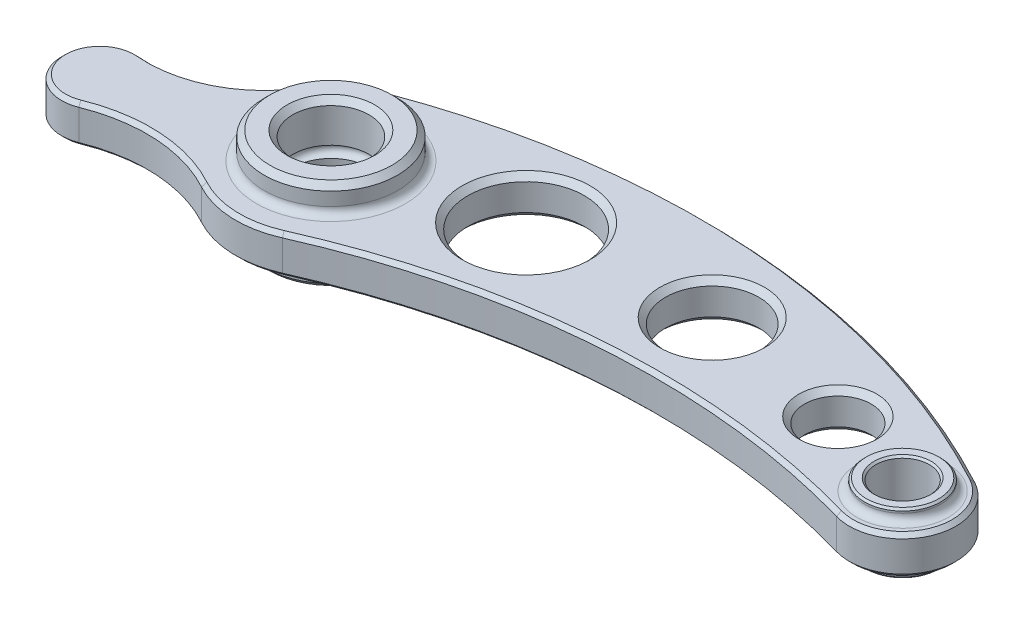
SolidWorks part; units mm, degrees
ref_plane "Front" through (0, 0, 0) normal (0, 0, 1) x (1, 0, 0)
ref_plane "Top" through (0, 0, 0) normal (0, 1, 0) x (1, 0, 0)
ref_plane "Right" through (0, 0, 0) normal (1, 0, 0) x (0, 0, -1)
sketch "Sketch1" plane through (0, 0, 0) normal (0, 1, 0) x (1, 0, 0)
  line L0 (0, 0) -> (150, 0) construction
  line L1 (0, 0) -> (-50, -10.6278) construction
  line L2 (0, 0) -> (-68.199, 0) construction
  arc A0 (-8.8233, 23.3912) -> (-21.1781, 13.2849) centre (0, 0) ccw
  arc A1 (146.1465, -13.4592) -> (156.6415, 12.3244) centre (150, 0) ccw
  arc A2 (10.1219, -22.8593) -> (146.1465, -13.4592) centre (91.0967, -205.7338) cw
  arc A3 (-8.8233, 23.3912) -> (156.6415, 12.3244) centre (61.7633, -163.7385) cw
  circle A4 centre (0, 0) radius 10
  circle A5 centre (150, 0) radius 7
  arc A6 (-21.1781, 13.2849) -> (-49.148, -0.6642) centre (-46.5918, 29.2267) cw
  arc A7 (-46.2534, -19.8994) -> (-12.0257, -21.9176) centre (-31.2668, -56.9859) cw
  arc A8 (-49.148, -0.6642) -> (-46.2534, -19.8994) centre (-50, -10.6278) ccw
  arc A9 (-12.0257, -21.9176) -> (10.1219, -22.8593) centre (0, 0) ccw
  arc A10 (-5.9999, 15.906) -> (152.8463, 5.2819) centre (61.7633, -163.7385) cw construction
  arc A11 (6.8829, -15.5443) -> (148.3485, -5.7682) centre (91.0967, -205.7338) cw construction
  circle A12 centre (0, 0) radius 26 construction
  circle A13 centre (150, 0) radius 18 construction
  circle A14 centre (39.6539, 11.5664) radius 15.3064
  circle A15 centre (124.6104, 8.4037) radius 8.7442
  circle A16 centre (85.6003, 14.4358) radius 12.2382
  circle A17 centre (85.6003, 14.4358) radius 30.7295 construction
  dimension "D2" = 25
  dimension "D3" = 14
  dimension "D4" = 200
  dimension "D5" = 200
  dimension "D6" = 20
  dimension "D7" = 14
  dimension "D10" = 10
  dimension "D11" = 40
  dimension "D12" = 30
  dimension "D1" = 150
  dimension "D8" = 12
  dimension "D9" = 50
  dimension "D13" = 8
  dimension "D14" = 8
  dimension "D15" = 16
  dimension "D16" = 11
extrude "Boss-Extrude1" add sketch "Sketch1" along normal mid plane 10
sketch "Sketch2" plane through (0, 0, 0) normal (0, 1, 0) x (1, 0, 0)
  circle A0 centre (0, 0) radius 10 construction
  circle A1 centre (0, 0) radius 10
  circle A2 centre (0, 0) radius 17.5
  dimension "D1" = 35
extrude "Boss-Extrude2" add sketch "Sketch2" along normal mid plane 24
sketch "Sketch3" plane through (0, 0, 0) normal (0, 1, 0) x (1, 0, 0)
  circle A0 centre (150, 0) radius 7 construction
  circle A1 centre (150, 0) radius 7
  circle A2 centre (150, 0) radius 10
  dimension "D1" = 20
extrude "Boss-Extrude3" add sketch "Sketch3" along normal mid plane 16
chamfer "Chamfer1" distance 1 angle 45 16 edges at (77.3084, 5, 6.2097) (162.967, 5, 5.2781) (-15.829, 5, -19.3506) (75.1101, 5, -35.8157) (77.3084, -5, 6.2097) (162.967, -5, 5.2781) (-15.829, -5, -19.3506) (75.1101, -5, -35.8157) (-28.9123, 5, 17.0552) (-1.062, 5, 24.9774) (-59.8887, 5, 12.1159) (-33.203, 5, -2.3801) (-28.9123, -5, 17.0552) (-1.062, -5, 24.9774) (-59.8887, -5, 12.1159) (-33.203, -5, -2.3801)
fillet "Fillet1" radius 2 4 edges at (150, -5, -10) (0, -5, -17.5) (150, 5, -10) (0, 5, -17.5)
chamfer "Chamfer2" distance 1.5 angle 45 4 edges at (0, -12, 10) (0, -12, 17.5) (0, 12, 10) (0, 12, 17.5)
chamfer "Chamfer3" distance 0.5 angle 45 4 edges at (150, -8, 7) (150, -8, 10) (150, 8, 7) (150, 8, 10)
sketch "Sketch4" plane through (0, 0, 0) normal (0, 0, 1) x (1, 0, 0)
  line L0 (-10, 10.5) -> (-10, -10.5) construction
  line L1 (0, 0) -> (0, 2.9962) construction
  circle A0 centre (-10, 0) radius 1.5
  dimension "D1" = 3
revolve "Cut-Revolve1" cut sketch "Sketch4" angle 360 about L1
chamfer "Chamfer4" distance 1.5 angle 45 6 edges at (124.6104, -5, 0.3405) (124.6104, 5, 0.3405) (85.6003, -5, -2.1976) (85.6003, 5, -2.1976) (39.6539, -5, 3.74) (39.6539, 5, 3.74)
